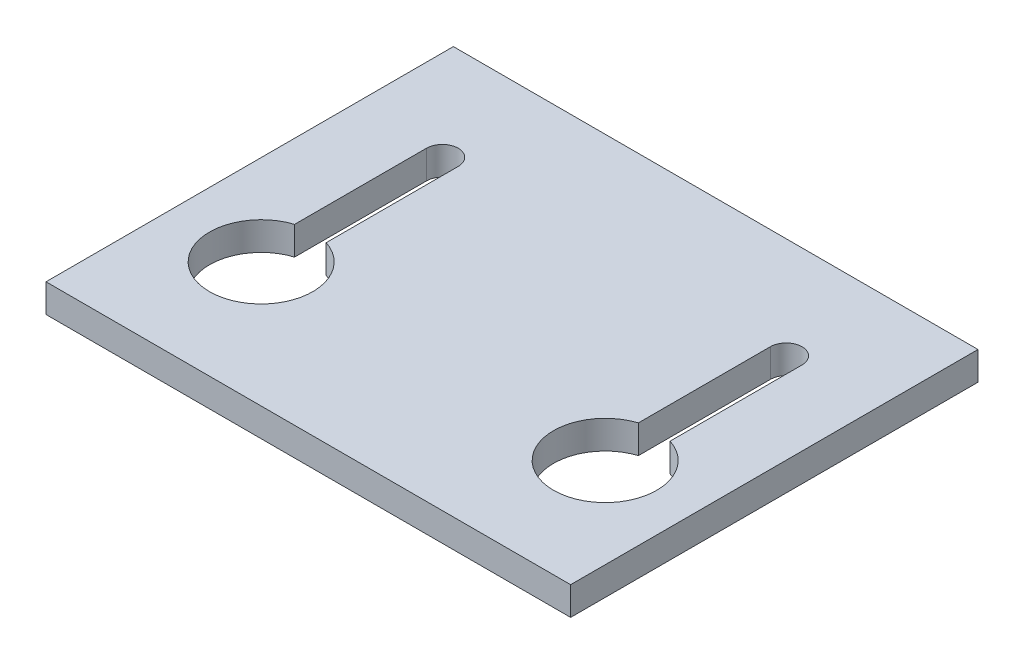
SolidWorks part; units mm, degrees
ref_plane "Front Plane" through (0, 0, 0) normal (0, 0, 1) x (1, 0, 0)
ref_plane "Top Plane" through (0, 0, 0) normal (0, 1, 0) x (1, 0, 0)
ref_plane "Right Plane" through (0, 0, 0) normal (1, 0, 0) x (0, 0, -1)
sketch "Sketch1" plane through (0, 0, 0) normal (0, 1, 0) x (1, 0, 0)
  line L1 (0, 0) -> (140.9403, 0)
  line L2 (0, 0) -> (0, -109.4399)
  line L3 (0, -109.4399) -> (140.9403, -109.4399)
  line L4 (140.9403, 0) -> (140.9403, -109.4399)
extrude "Extrude1" add sketch "Sketch1" along normal blind 7.62
sketch "Sketch2" plane through (0, 7.62, 0) normal (0, 1, 0) x (-1, 0, 0)
  line L0 (-28.5382, 27.2481) -> (-28.5382, 62.7032)
  line L1 (-20.0305, 27.2481) -> (-20.0305, 62.6881)
  arc A0 (-20.0305, 62.6881) -> (-28.5382, 62.7032) centre (-24.2609, 75.903) ccw
  arc A1 (-28.5382, 27.2481) -> (-20.0305, 27.2481) centre (-24.2843, 27.2481) ccw
extrude "Cut-Extrude1" cut sketch "Sketch2" against normal through all
ref_plane "Plane1" through (70.4702, 0, 0) normal (1, 0, 0) x (0, 0, -1)
mirror "Mirror1" about plane through (70.4702, 0, 0) normal (1, 0, 0) of "Cut-Extrude1"
